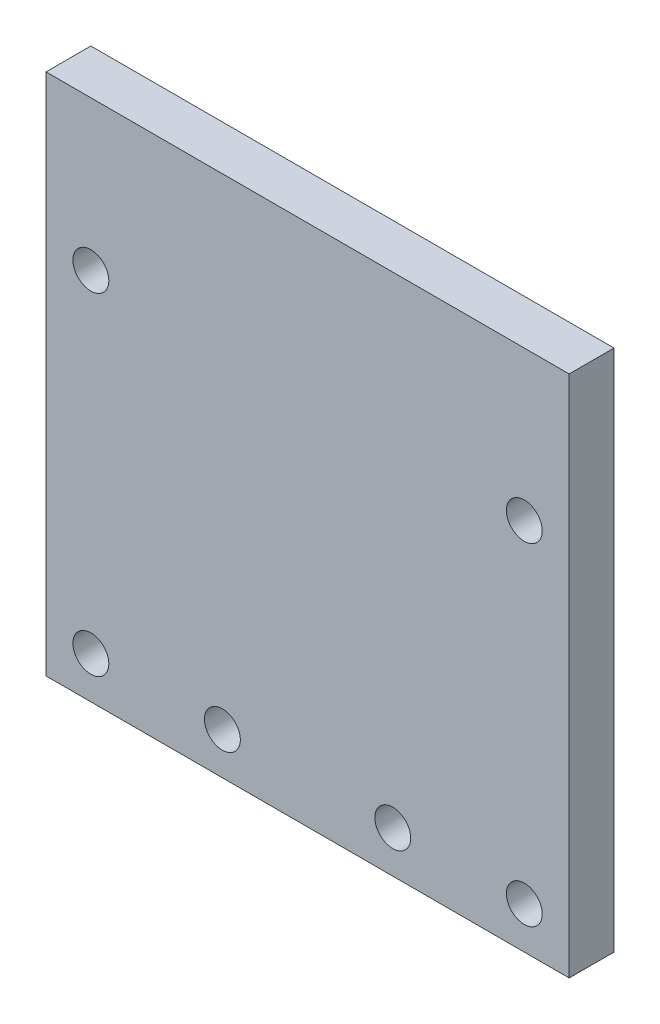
SolidWorks part; units mm, degrees
ref_plane "Front" through (0, 0, 0) normal (0, 0, 1) x (1, 0, 0)
ref_plane "Top" through (0, 0, 0) normal (0, 1, 0) x (1, 0, 0)
ref_plane "Right" through (0, 0, 0) normal (1, 0, 0) x (0, 0, -1)
imported_body "Импортированный1"
hole_wizard "Отверстие с зазором M21" positions "Эскиз1" profile "Эскиз2" hole size "M2" standard "DIN"
sketch "Эскиз1" plane through (0, 0, 3) normal (0, 0, 1) x (1, 0, 0)
  point P0 (3, 25)
  point P3 (32, 25)
  point P6 (32, 2.8)
  point P9 (23.2, 2.8)
  point P12 (11.8, 2.8)
  point P15 (3, 2.8)
sketch "Эскиз2" plane through (3, 25, 3) normal (1, 0, 0) x (0, -1, 0)
  line L0 (0, 0) -> (0, 3)
  line L1 (0, 3) -> (1.2, 3)
  line L2 (1.2, 3) -> (1.2, 0)
  line L5 (1.2, 0) -> (0, 0)
  line L11 (0, -6.35) -> (0, 107.95) construction
  dimension "Диаметр сквозного отверстия" = 2.4
  dimension "Глубина сквозного отверстия" = 3
